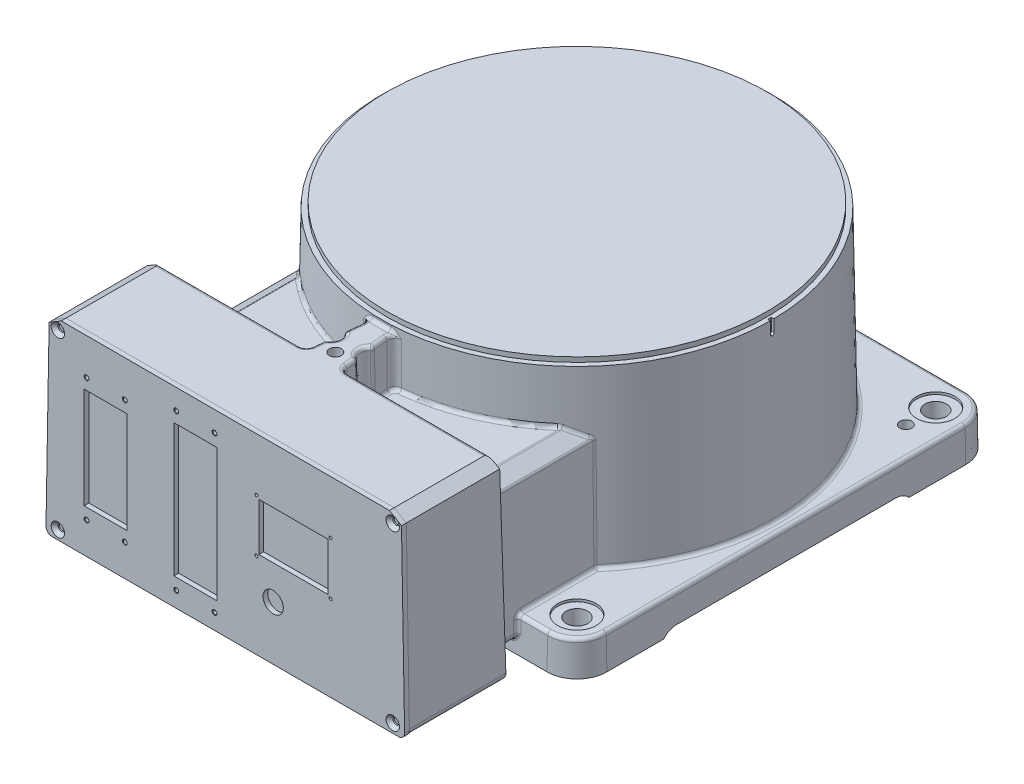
SolidWorks part; units mm, degrees
ref_plane "前视基准面" through (0, 0, 0) normal (0, 0, 1) x (1, 0, 0)
ref_plane "上视基准面" through (0, 0, 0) normal (0, 1, 0) x (1, 0, 0)
ref_plane "右视基准面" through (0, 0, 0) normal (1, 0, 0) x (0, 0, -1)
imported_body "输入1"
imported_body "输入2"
sketch "草图1" plane through (0, 26, 0) normal (0, 1, 0) x (1, 0, 0)
  circle A0 centre (155, 115) radius 4.25
  circle A1 centre (155, -115) radius 4.25
  circle A2 centre (-155, 115) radius 4.25
  circle A3 centre (-155, -115) radius 4.25
extrude "凸台-拉伸1" add sketch "草图1" against normal up to surface (29 mm away)
sketch "草图2" plane through (0, 7, 0) normal (0, -1, 0) x (1, 0, 0)
  circle A0 centre (150, 150) radius 14.5
  circle A1 centre (150, 150) radius 9
  circle A2 centre (-150, -150) radius 14.5
  circle A3 centre (-150, -150) radius 9
extrude "凸台-拉伸2" add sketch "草图2" along normal up to surface (10 mm away)
hole_wizard "大小mm 暗销孔1" positions "草图3" profile "草图4" hole size "Ø10.0" standard "ISO"
sketch "草图3" plane through (0, 26, 0) normal (0, 1, 0) x (-1, 0, 0)
  point P0 (-150, -125)
  point P2 (150, 125)
  dimension "D1" = 250
  dimension "D2" = 125
  dimension "D3" = 300
  dimension "D4" = 150
sketch "草图4" plane through (150, 26, -125) normal (1, 0, 0) x (0, 0, 1)
  line L0 (0, 0) -> (0, 29)
  line L1 (0, 29) -> (5, 29)
  line L2 (5, 29) -> (5, 0)
  line L5 (5, 0) -> (0, 0)
  line L11 (0, -6.35) -> (0, 107.95) construction
  dimension "通孔孔直径" = 10
  dimension "通孔孔深度" = 29
